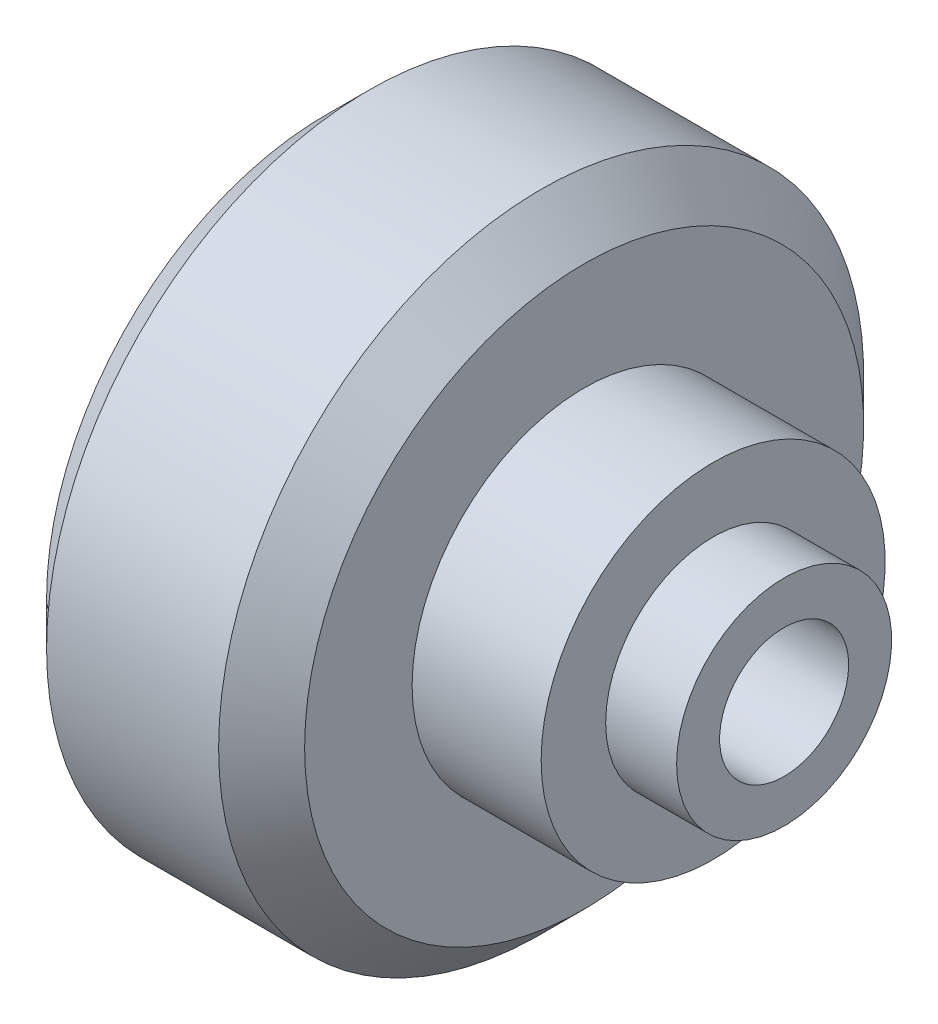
SolidWorks part; units mm, degrees
ref_plane "Front" through (0, 0, 0) normal (0, 0, 1) x (1, 0, 0)
ref_plane "Top" through (0, 0, 0) normal (0, 1, 0) x (1, 0, 0)
ref_plane "Right" through (0, 0, 0) normal (1, 0, 0) x (0, 0, -1)
sketch "Sketch1" plane through (0, 0, 0) normal (0, 1, 0) x (1, 0, 0)
  line L0 (0, 0) -> (21.3, 0)
  line L1 (21.3, 0) -> (21.3, 5)
  line L2 (21.3, 5) -> (18, 5)
  line L3 (18, 5) -> (18, 8)
  line L4 (18, 8) -> (12, 8)
  line L5 (12, 8) -> (12, 13)
  line L6 (10, 15) -> (2, 15)
  line L7 (0, 13) -> (0, 0)
  line L8 (2, 15) -> (0, 13)
  line L9 (12, 13) -> (10, 15)
  point P8 (12, 15)
  point P9 (0, 15)
revolve "Revolve1" add sketch "Sketch1" angle 360 about L0
sketch "Sketch2" plane through (21.3, 0, 0) normal (1, 0, 0) x (0, 0, -1)
  circle A0 centre (0, 0) radius 3
extrude "Cut-Extrude1" cut sketch "Sketch2" against normal through all
sketch "Sketch3" plane through (0, 0, 0) normal (-1, 0, 0) x (0, 0, 1)
  circle A0 centre (0, 0) radius 8
extrude "Cut-Extrude2" cut sketch "Sketch3" against normal blind 5
